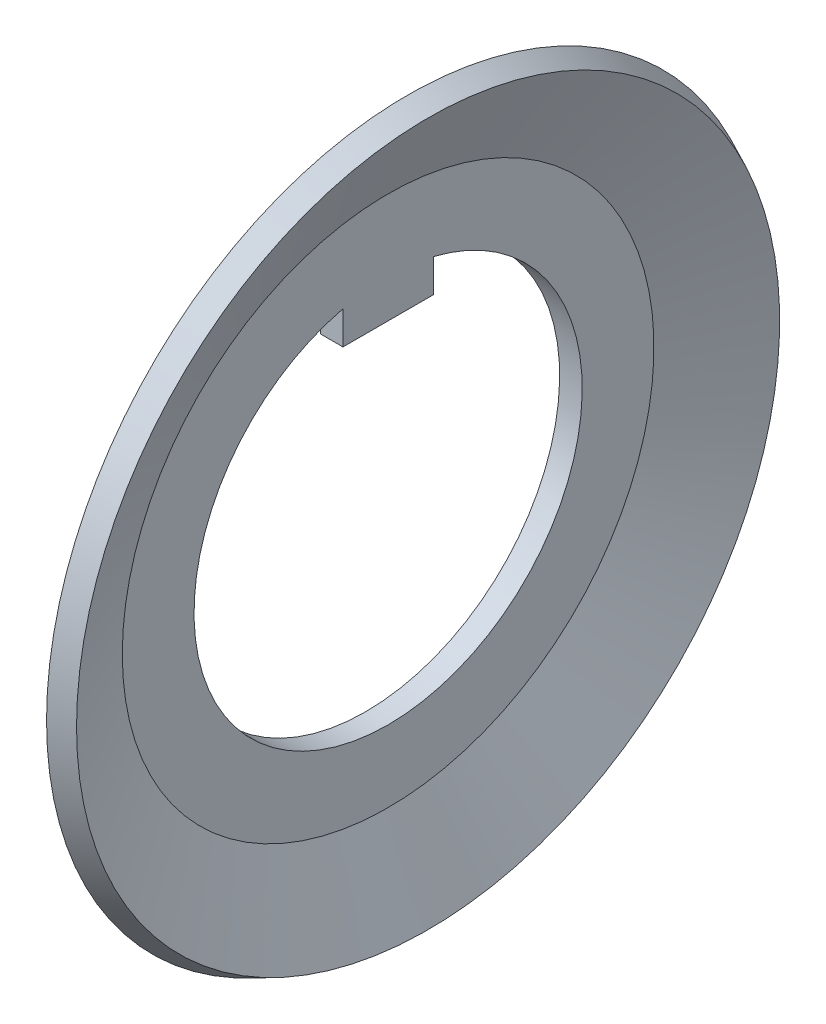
SolidWorks part; units mm, degrees
ref_plane "Face" through (0, 0, 0) normal (0, 0, 1) x (1, 0, 0)
ref_plane "Dessus" through (0, 0, 0) normal (0, 1, 0) x (1, 0, 0)
ref_plane "Droite" through (0, 0, 0) normal (1, 0, 0) x (0, 0, -1)
sketch "Esquisse1" plane through (0, 0, 0) normal (0, 0, 1) x (1, 0, 0)
  line L0 (0, 0) -> (15.9417, 0) construction
  line L1 (0, 8.6) -> (0, 12)
  line L2 (0, 12) -> (1.8652, 16)
  line L3 (1.8652, 16) -> (2.7715, 15.5774)
  line L4 (2.7715, 15.5774) -> (1, 11.7783)
  line L5 (1, 11.7783) -> (1, 8.6)
  line L6 (0, 8.6) -> (1, 8.6)
  dimension "D1" = 17.2
  dimension "D2" = 1
  dimension "D3" = 1
  dimension "D4" = 24
  dimension "D5" = 32
  dimension "D6" = 65
revolve "Révolution1" add sketch "Esquisse1" angle 360 about L0
sketch "Esquisse3" plane through (0, 0, 0) normal (-1, 0, 0) x (0, 0, 1)
  line L1 (-2, 9.689) -> (2, 9.689)
  line L2 (-2, 9.689) -> (-2, 6.9)
  line L3 (-2, 6.9) -> (2, 6.9)
  line L4 (2, 9.689) -> (2, 6.9)
  circle A0 centre (0, 0) radius 8.6 construction
  dimension "D1" = 15.5
  dimension "D2" = 4
  dimension "D3" = 2
extrude "Extrusion1" add sketch "Esquisse3" against normal blind 1
